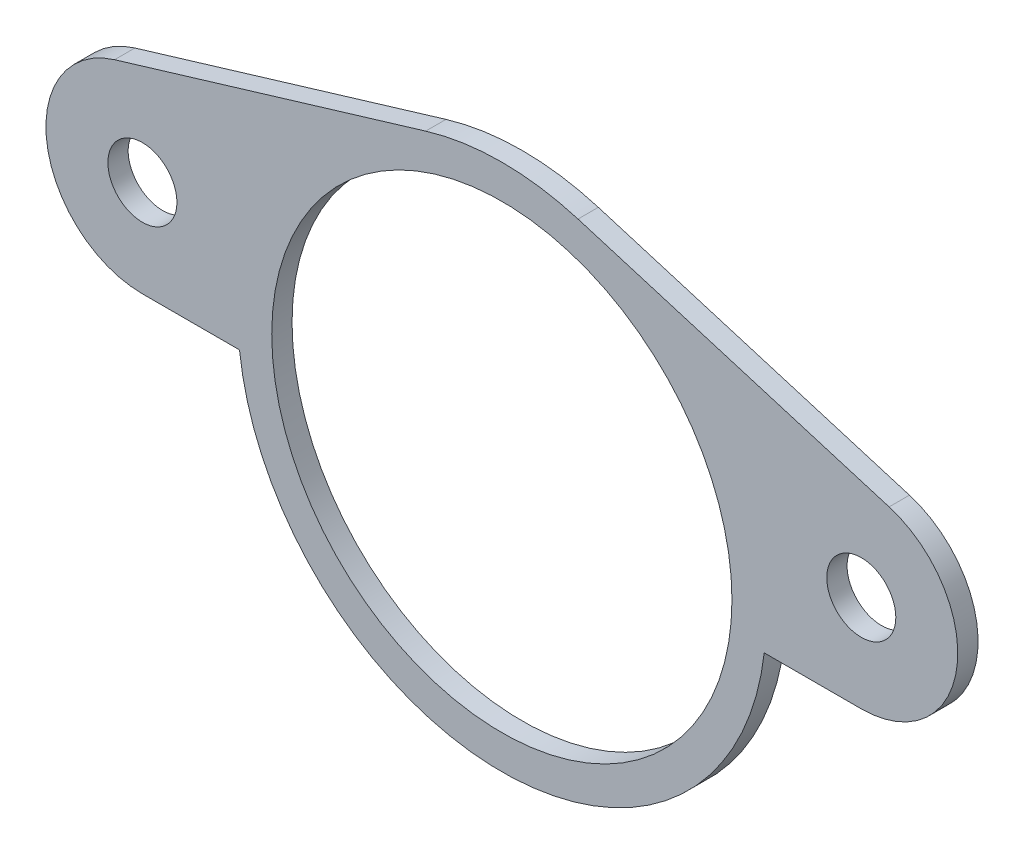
SolidWorks part; units mm, degrees
ref_plane "Front Plane" through (0, 0, 0) normal (0, 0, 1) x (1, 0, 0)
ref_plane "Top Plane" through (0, 0, 0) normal (0, 1, 0) x (1, 0, 0)
ref_plane "Right Plane" through (0, 0, 0) normal (1, 0, 0) x (0, 0, -1)
sketch "Sketch1" plane through (0, 0, 0) normal (0, 0, 1) x (1, 0, 0)
  line L0 (0, 0) -> (0, -25) construction
  line L1 (0, -25) -> (-28.2843, 3.2843) construction
  line L2 (0, -25) -> (-7.2742, -25) construction
  line L3 (12.9171, -1.4657) -> (17.6978, -1.4657)
  line L4 (-17.6978, 3.2843) -> (17.6978, 3.2843) construction
  line L5 (-12.9171, -1.4657) -> (-17.6978, -1.4657)
  line L6 (-19.0681, 7.8323) -> (-3.7501, 12.4473)
  line L7 (3.7501, 12.4473) -> (19.0681, 7.8323)
  circle A0 centre (0, 0) radius 11.33 construction
  circle A1 centre (0, 0) radius 18 construction
  circle A2 centre (-17.6978, 3.2843) radius 1.7
  circle A3 centre (17.6978, 3.2843) radius 1.7
  arc A4 (-33.5842, -3.2721) -> (36.2339, -8.0559) centre (0, -25) cw construction
  circle A5 centre (0, 0) radius 13 construction
  arc A6 (-12.7279, -12.2721) -> (9.6253, -9.7897) centre (0, -25) cw construction
  arc A7 (12.9171, -1.4657) -> (-12.9171, -1.4657) centre (0, 0) cw
  arc A8 (-19.0681, 7.8323) -> (-17.6978, -1.4657) centre (-17.6978, 3.2843) ccw
  arc A9 (-3.7501, 12.4473) -> (3.7501, 12.4473) centre (0, 0) cw
  arc A10 (19.0681, 7.8323) -> (17.6978, -1.4657) centre (17.6978, 3.2843) cw
  circle A11 centre (0, 0) radius 11.33
  dimension "D1" = 22.66
  dimension "D2" = 36
  dimension "D3" = 3.4
  dimension "D5" = 40
  dimension "D7" = 26
  dimension "D8" = 18
  dimension "D4" = 25
  dimension "D6" = 45
  dimension "D9" = 4.75
extrude "Boss-Extrude1" add sketch "Sketch1" along normal blind 1
